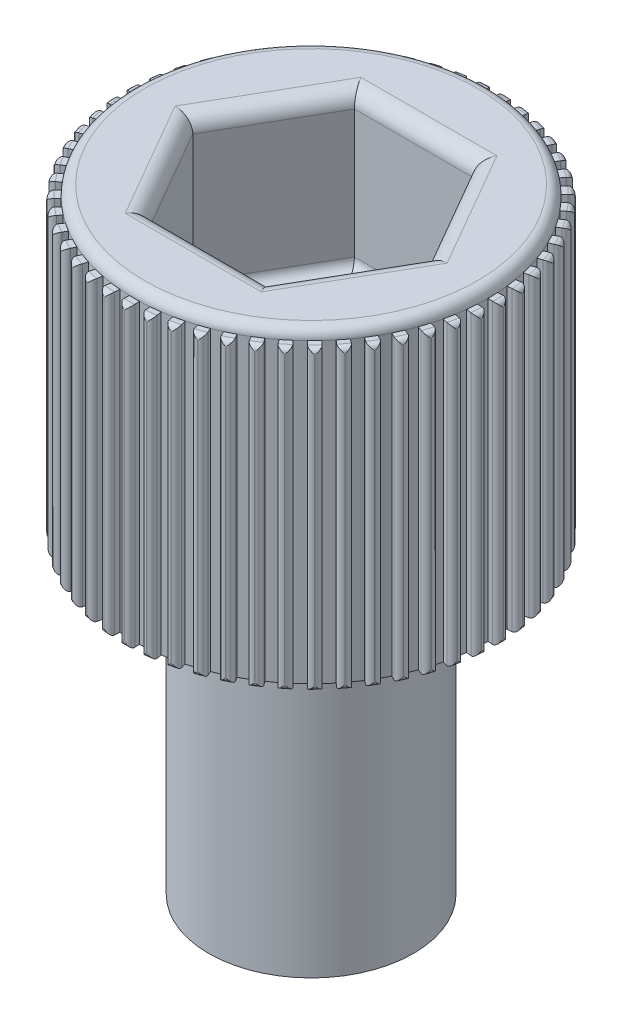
SolidWorks part; units mm, degrees
ref_plane "Front Plane" through (0, 0, 0) normal (0, 0, 1) x (1, 0, 0)
ref_plane "Top Plane" through (0, 0, 0) normal (0, 1, 0) x (1, 0, 0)
ref_plane "Right Plane" through (0, 0, 0) normal (1, 0, 0) x (0, 0, -1)
sketch "Sketch1" plane through (0, 0, 0) normal (0, 0, 1) x (1, 0, 0)
  line L0 (0, 0) -> (0, 57.5065) construction
  line L1 (0, 0) -> (2.54, 0)
  line L2 (2.54, 0) -> (2.54, 7.62)
  line L3 (2.54, 7.62) -> (4.6355, 7.62)
  line L4 (4.6355, 7.62) -> (4.6355, 15.24)
  line L5 (4.6355, 15.24) -> (0, 15.24)
  line L6 (0, 15.24) -> (0, 0)
  dimension "D1" = 2.54
  dimension "D2" = 7.62
  dimension "D3" = 7.62
  dimension "D4" = 4.6355
revolve "Revolve1" add sketch "Sketch1" angle 360 about L0
sketch "Sketch2" plane through (0, 15.24, 0) normal (0, 1, 0) x (-1, 0, 0)
  line L1 (-2.9329, 0) -> (-1.4665, -2.54)
  line L2 (-1.4665, -2.54) -> (1.4665, -2.54)
  line L3 (1.4665, -2.54) -> (2.9329, 0)
  line L4 (2.9329, 0) -> (1.4665, 2.54)
  line L5 (1.4665, 2.54) -> (-1.4665, 2.54)
  line L6 (-1.4665, 2.54) -> (-2.9329, 0)
  circle A0 centre (0, 0) radius 2.54 construction
  dimension "D1" = 5.08
extrude "Cut-Extrude1" cut sketch "Sketch2" against normal blind 3.81
sketch "Sketch3" plane through (0, 15.24, 0) normal (0, 1, 0) x (-1, 0, 0)
  circle A0 centre (0, 0) radius 4.6355
  circle A1 centre (0, 0) radius 4.3815
  circle A2 centre (0, 0) radius 4.6355 construction
  dimension "D1" = 0.254
extrude "Cut-Extrude2" cut sketch "Sketch3" against normal blind 0.254
fillet "Fillet1" radius 0.254 1 edges at (0, 15.24, 4.3815)
sketch "Sketch4" plane through (0, 14.986, 0) normal (0, 1, 0) x (1, 0, 0)
  line L0 (-0.127, 4.3797) -> (-0.127, 4.8877)
  line L1 (-0.127, 4.8877) -> (0.127, 4.8877)
  line L2 (0.127, 4.8877) -> (0.127, 4.3797)
  circle A0 centre (0, 0) radius 4.3815
  dimension "D3" = 8.763
  dimension "D2" = 0.508
  dimension "D1" = 0.254
extrude "Cut-Extrude3" cut sketch "Sketch4" against normal through all contours L2 L0 M3 M2 | L2 L1 L0 M3
pattern_circular "CirPattern1" count 55 over 360 about axis through (0, 0, 0) along (0, 1, 0) of "Cut-Extrude3"
fillet "Fillet2" radius 0.127 116 edges at (0.9258, 11.303, -4.5421) (0.7905, 14.986, -4.5676) (0.6544, 11.303, -4.5891) (0.7905, 7.62, -4.5676) (1.4376, 11.303, -4.407) (1.306, 14.986, -4.4477) (1.1732, 11.303, -4.4846) (1.306, 7.62, -4.4477) (1.9305, 11.303, -4.2144) (1.8045, 14.986, -4.2699) (1.6768, 11.303, -4.3216) (1.8045, 7.62, -4.2699) (2.3984, 11.303, -3.9668) (2.2794, 14.986, -4.0363) (2.1585, 11.303, -4.1023) (2.2794, 7.62, -4.0363) (2.8349, 11.303, -3.6676) (2.7247, 14.986, -3.7502) (2.612, 11.303, -3.8295) (2.7247, 7.62, -3.7502) (3.2345, 11.303, -3.3205) (3.1344, 14.986, -3.4152) (3.0315, 11.303, -3.5068) (3.1344, 7.62, -3.4152) (3.5919, 11.303, -2.9302) (3.5033, 14.986, -3.0356) (3.4115, 11.303, -3.1384) (3.5033, 7.62, -3.0356) (3.9025, 11.303, -2.5016) (3.8265, 14.986, -2.6165) (3.747, 11.303, -2.729) (3.8265, 7.62, -2.6165) (4.1623, 11.303, -2.0405) (4.0998, 14.986, -2.1632) (4.0337, 11.303, -2.2841) (4.0998, 7.62, -2.1632) (4.3677, 11.303, -1.5527) (4.3197, 14.986, -1.6818) (4.2678, 11.303, -1.8094) (4.3197, 7.62, -1.6818) (4.5162, 11.303, -1.0447) (4.4832, 14.986, -1.1784) (4.4462, 11.303, -1.3111) (4.4832, 7.62, -1.1784) (4.6059, 11.303, -0.5231) (4.5883, 14.986, -0.6597) (4.5667, 11.303, -0.7958) (4.5883, 7.62, -0.6597) (4.6355, 11.303, 0.0054) (4.6336, 14.986, -0.1324) (4.6276, 11.303, -0.27) (4.6336, 7.62, -0.1324) (4.6047, 11.303, 0.5337) (4.6185, 14.986, 0.3967) (4.6282, 11.303, 0.2593) (4.6185, 7.62, 0.3967) (4.5138, 11.303, 1.0552) (4.5432, 14.986, 0.9206) (4.5685, 11.303, 0.7852) (4.5432, 7.62, 0.9206) (4.3641, 11.303, 1.5628) (4.4086, 14.986, 1.4324) (4.4492, 11.303, 1.3008) (4.4086, 7.62, 1.4324) (4.1575, 11.303, 2.0501) (4.2166, 14.986, 1.9257) (4.272, 11.303, 1.7995) (4.2166, 7.62, 1.9257) (3.8967, 11.303, 2.5107) (3.9696, 14.986, 2.3938) (4.039, 11.303, 2.2747) (3.9696, 7.62, 2.3938) (3.5851, 11.303, 2.9385) (3.6709, 14.986, 2.8307) (3.7534, 11.303, 2.7203) (3.6709, 7.62, 2.8307) (3.2268, 11.303, 3.328) (3.3243, 14.986, 3.2307) (3.4188, 11.303, 3.1304) (3.3243, 7.62, 3.2307) (2.8264, 11.303, 3.6741) (2.9343, 14.986, 3.5885) (3.0397, 11.303, 3.4998) (2.9343, 7.62, 3.5885) (2.3892, 11.303, 3.9724) (2.5061, 14.986, 3.8996) (2.6209, 11.303, 3.8234) (2.5061, 7.62, 3.8996) (1.9208, 11.303, 4.2188) (2.0453, 14.986, 4.1599) (2.168, 11.303, 4.0973) (2.0453, 7.62, 4.1599) (1.4273, 11.303, 4.4103) (1.5578, 14.986, 4.3659) (1.6868, 11.303, 4.3177) (1.5578, 7.62, 4.3659) (0.9153, 11.303, 4.5442) (1.0499, 14.986, 4.515) (1.1836, 11.303, 4.4818) (1.0499, 7.62, 4.515) (0.3913, 11.303, 4.619) (0.5284, 14.986, 4.6053) (0.665, 11.303, 4.5875) (0.5284, 7.62, 4.6053) (-0.1377, 11.303, 4.6335) (0, 14.986, 4.6355) (0.1377, 11.303, 4.6335) (0, 7.62, 4.6355) (-0.665, 11.303, 4.5875) (-0.5284, 14.986, 4.6053) (-0.3913, 11.303, 4.619) (-0.5284, 7.62, 4.6053) (-1.1836, 11.303, 4.4818) (-1.0499, 14.986, 4.515) (-0.9153, 11.303, 4.5442) (-1.0499, 7.62, 4.515)
fillet "Fillet3" radius 0.127 104 edges at (-1.6868, 11.303, 4.3177) (-1.5578, 14.986, 4.3659) (-1.4273, 11.303, 4.4103) (-1.5578, 7.62, 4.3659) (-2.168, 11.303, 4.0973) (-2.0453, 14.986, 4.1599) (-1.9208, 11.303, 4.2188) (-2.0453, 7.62, 4.1599) (-2.6209, 11.303, 3.8234) (-2.5061, 14.986, 3.8996) (-2.3892, 11.303, 3.9724) (-2.5061, 7.62, 3.8996) (-3.0397, 11.303, 3.4998) (-2.9343, 14.986, 3.5885) (-2.8264, 11.303, 3.6741) (-2.9343, 7.62, 3.5885) (-3.4188, 11.303, 3.1304) (-3.3243, 14.986, 3.2307) (-3.2268, 11.303, 3.328) (-3.3243, 7.62, 3.2307) (-3.7534, 11.303, 2.7203) (-3.6709, 14.986, 2.8307) (-3.5851, 11.303, 2.9385) (-3.6709, 7.62, 2.8307) (-4.039, 11.303, 2.2747) (-3.9696, 14.986, 2.3938) (-3.8967, 11.303, 2.5107) (-3.9696, 7.62, 2.3938) (-4.272, 11.303, 1.7995) (-4.2166, 14.986, 1.9257) (-4.1575, 11.303, 2.0501) (-4.2166, 7.62, 1.9257) (-4.4492, 11.303, 1.3008) (-4.4086, 14.986, 1.4324) (-4.3641, 11.303, 1.5628) (-4.4086, 7.62, 1.4324) (-4.5685, 11.303, 0.7852) (-4.5432, 14.986, 0.9206) (-4.5138, 11.303, 1.0552) (-4.5432, 7.62, 0.9206) (-4.6282, 11.303, 0.2593) (-4.6185, 14.986, 0.3967) (-4.6047, 11.303, 0.5337) (-4.6185, 7.62, 0.3967) (-4.6276, 11.303, -0.27) (-4.6336, 14.986, -0.1324) (-4.6355, 11.303, 0.0054) (-4.6336, 7.62, -0.1324) (-4.5667, 11.303, -0.7958) (-4.5883, 14.986, -0.6597) (-4.6059, 11.303, -0.5231) (-4.5883, 7.62, -0.6597) (-4.4462, 11.303, -1.3111) (-4.4832, 14.986, -1.1784) (-4.5162, 11.303, -1.0447) (-4.4832, 7.62, -1.1784) (-4.2678, 11.303, -1.8094) (-4.3197, 14.986, -1.6818) (-4.3677, 11.303, -1.5527) (-4.3197, 7.62, -1.6818) (-4.0337, 11.303, -2.2841) (-4.0998, 14.986, -2.1632) (-4.1623, 11.303, -2.0405) (-4.0998, 7.62, -2.1632) (-3.747, 11.303, -2.729) (-3.8265, 14.986, -2.6165) (-3.9025, 11.303, -2.5016) (-3.8265, 7.62, -2.6165) (-3.4115, 11.303, -3.1384) (-3.5033, 14.986, -3.0356) (-3.5919, 11.303, -2.9302) (-3.5033, 7.62, -3.0356) (-3.0315, 11.303, -3.5068) (-3.1344, 14.986, -3.4152) (-3.2345, 11.303, -3.3205) (-3.1344, 7.62, -3.4152) (-2.612, 11.303, -3.8295) (-2.7247, 14.986, -3.7502) (-2.8349, 11.303, -3.6676) (-2.7247, 7.62, -3.7502) (-2.1585, 11.303, -4.1023) (-2.2794, 14.986, -4.0363) (-2.3984, 11.303, -3.9668) (-2.2794, 7.62, -4.0363) (-1.6768, 11.303, -4.3216) (-1.8045, 14.986, -4.2699) (-1.9305, 11.303, -4.2144) (-1.8045, 7.62, -4.2699) (-1.1732, 11.303, -4.4846) (-1.306, 14.986, -4.4477) (-1.4376, 11.303, -4.407) (-1.306, 7.62, -4.4477) (-0.6544, 11.303, -4.5891) (-0.7905, 14.986, -4.5676) (-0.9258, 11.303, -4.5421) (-0.7905, 7.62, -4.5676) (-0.127, 11.303, -4.6338) (-0.2646, 14.986, -4.6279) (-0.402, 11.303, -4.618) (-0.2646, 7.62, -4.6279) (0.127, 11.303, -4.6338) (0.2646, 7.62, -4.6279) (0.402, 11.303, -4.618) (0.2646, 14.986, -4.6279)
fillet "Fillet5" radius 0.254 6 edges at (0, 11.43, 2.54) (-2.1997, 11.43, 1.27) (-2.1997, 11.43, -1.27) (0, 11.43, -2.54) (2.1997, 11.43, -1.27) (2.1997, 11.43, 1.27)
fillet "Fillet6" radius 0.381 6 edges at (2.1997, 15.24, 1.27) (0, 15.24, 2.54) (-2.1997, 15.24, 1.27) (-2.1997, 15.24, -1.27) (0, 15.24, -2.54) (2.1997, 15.24, -1.27)
